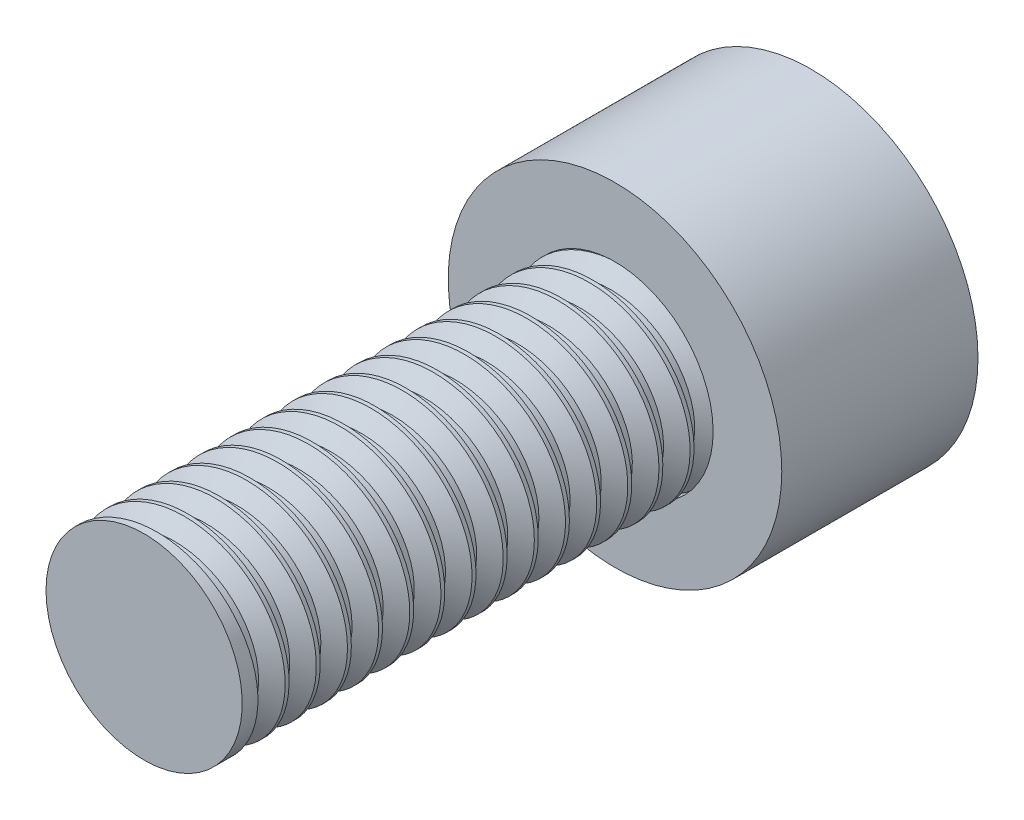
SolidWorks part; units mm, degrees
ref_plane "前视基准面" through (0, 0, 0) normal (0, 0, 1) x (1, 0, 0)
ref_plane "上视基准面" through (0, 0, 0) normal (0, 1, 0) x (1, 0, 0)
ref_plane "右视基准面" through (0, 0, 0) normal (1, 0, 0) x (0, 0, -1)
sketch "草图1" plane through (0, 0, 0) normal (0, 0, 1) x (1, 0, 0)
  circle A0 centre (0, 0) radius 4.25
  dimension "D1" = 8.5
extrude "凸台-拉伸1" add sketch "草图1" along normal blind 5
sketch "草图2" plane through (0, 0, 5) normal (0, 0, 1) x (1, 0, 0)
  circle A0 centre (0, 0) radius 2.5
  dimension "D1" = 5
extrude "凸台-拉伸2" add sketch "草图2" along normal blind 12
thread "螺纹线1" pitch 0.7937 start angle 0, offset 0, length 12, pitch 0.7937, diameter 5
ref_plane "基准面4" through (-2.5, 0, 17) normal (0, -1, 0) x (-1, 0, 0)
sketch "螺纹线轮廓1" plane through (-2.5, 0, 17) normal (0, -1, 0) x (-1, 0, 0)
  line L0 (0, 0) -> (0, 0.7937) construction
  line L11 (0, 0) -> (0, 0.6945)
  line L12 (0, 0.6945) -> (-0.4296, 0.4465)
  line L13 (-0.4296, 0.4465) -> (-0.4296, 0.248)
  line L15 (-0.4296, 0.248) -> (0, 0)
  line L17 (-0.4296, 0.3473) -> (0, 0.3473) construction
  point P2 (0, 0)
  dimension "Pitch" = 0.7937
  dimension "Profile_Angle" = 60
  dimension "Profile_Land" = 0.1984
  dimension "Profile_Height" = 0.4296
sketch "草图14" plane through (0, 0, 0) normal (0, 0, -1) x (-1, 0, 0)
  line L1 (1.0742, -2.0443) -> (2.3076, -0.0919)
  line L2 (2.3076, -0.0919) -> (1.2333, 1.9525)
  line L3 (1.2333, 1.9525) -> (-1.0742, 2.0443)
  line L4 (-1.0742, 2.0443) -> (-2.3076, 0.0919)
  line L5 (-2.3076, 0.0919) -> (-1.2333, -1.9525)
  line L6 (-1.2333, -1.9525) -> (1.0742, -2.0443)
  circle A0 centre (0, 0) radius 2 construction
  dimension "D1" = 4
extrude "切除-拉伸1" cut sketch "草图14" against normal blind 2
